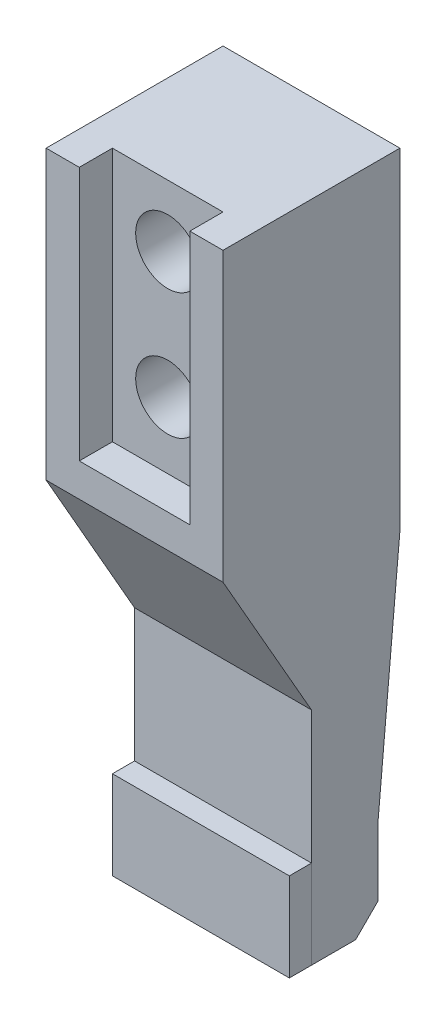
SolidWorks part; units mm, degrees
ref_plane "前视基准面" through (0, 0, 0) normal (0, 0, 1) x (1, 0, 0)
ref_plane "上视基准面" through (0, 0, 0) normal (0, 1, 0) x (1, 0, 0)
ref_plane "右视基准面" through (0, 0, 0) normal (1, 0, 0) x (0, 0, -1)
sketch "草图1" plane through (0, 0, 0) normal (0, 0, 1) x (1, 0, 0)
  line L1 (-4, -15) -> (4, -15)
  line L2 (-4, -15) -> (-4, 15)
  line L3 (-4, 15) -> (4, 15)
  line L4 (4, -15) -> (4, 15)
  line L5 (0, 15) -> (0, -15) construction
  line L6 (-4, 0) -> (4, 0) construction
  point P0 (0, 0)
  dimension "D1" = 30
  dimension "D2" = 8
extrude "凸台-拉伸1" add sketch "草图1" along normal blind 8
sketch "草图2" plane through (0, 0, 8) normal (0, 0, 1) x (1, 0, 0)
  line L0 (4, 15) -> (-4, 15) construction
  line L1 (-2.5, 15) -> (2.5, 15)
  line L2 (-2.5, 15) -> (-2.5, 3.5)
  line L3 (-2.5, 3.5) -> (2.5, 3.5)
  line L4 (2.5, 15) -> (2.5, 3.5)
  line L5 (0, 0) -> (0, 3.5) construction
  dimension "D1" = 5
  dimension "D2" = 11.5
extrude "切除-拉伸1" cut sketch "草图2" against normal blind 1.5
sketch "草图3" plane through (4, 0, 0) normal (1, 0, 0) x (0, 0, -1)
  line L0 (-8, 2) -> (-4, -5)
  line L1 (-8, -15) -> (-4.5, -15)
  line L2 (-4, -5) -> (-4, -11)
  line L3 (-4, -11) -> (-4.5, -11)
  line L4 (-4.5, -11) -> (-4.5, -15) construction
  line L5 (-8, -15) -> (0, -15) construction
  line L6 (-8, -15) -> (-8, 2)
  line L7 (-4, -11) -> (-4, -15)
  line L8 (-4.5, -15) -> (-4, -15)
  dimension "D1" = 4
  dimension "D2" = 0.5
  dimension "D3" = 4
  dimension "D4" = 17
  dimension "D5" = 6
extrude "切除-拉伸2" cut sketch "草图3" against normal through all and the other way through all contours L4 L3 L2 L0 M8 M9 | L3 L4 L7 M9
hole_wizard "M2.5 间隙孔1" positions "草图4" profile "草图5" hole size "M2.5" standard "GB"
sketch "草图4" plane through (0, 0, 0) normal (0, 0, -1) x (-1, 0, 0)
  point P0 (0, 6.5)
  point P2 (0, 12.2)
sketch "草图5" plane through (0, 6.5, 0) normal (1, 0, 0) x (0, 1, 0)
  line L0 (0, 0) -> (0, 8)
  line L1 (0, 8) -> (1.45, 8)
  line L2 (1.45, 8) -> (1.45, 0)
  line L5 (1.45, 0) -> (0, 0)
  line L11 (0, -6.35) -> (0, 107.95) construction
  dimension "通孔孔直径" = 2.9
  dimension "通孔孔深度" = 8
chamfer "倒角1" [suppressed] distance 3 angle 45
chamfer "倒角2" [suppressed] distance 1 angle 45
sketch "草图6" plane through (4, 0, 0) normal (1, 0, 0) x (0, 0, -1)
  line L0 (-1, -15) -> (-1, -11)
  line L2 (-1, -11) -> (0, 0)
  line L3 (0, -15) -> (0, 15) construction
  line L4 (0, 0) -> (0, -15)
  line L5 (0, -15) -> (-1, -15)
  dimension "D1" = 15
  dimension "D2" = 4
  dimension "D3" = 1
extrude "切除-拉伸3" cut sketch "草图6" against normal through all
chamfer "倒角3" distance 1 angle 45 1 edges at (0, -15, 1)
sketch "草图7" plane through (0, 0, 4) normal (0, 0, 1) x (1, 0, 0)
  line L0 (4, -15) -> (4, -5) construction
  line L1 (-4, -15) -> (4, -15)
  line L2 (-4, -15) -> (-4, -11)
  line L3 (-4, -11) -> (4, -11)
  line L4 (4, -15) -> (4, -11)
  dimension "D1" = 4
extrude "凸台-拉伸2" add sketch "草图7" along normal blind 1 separate body
